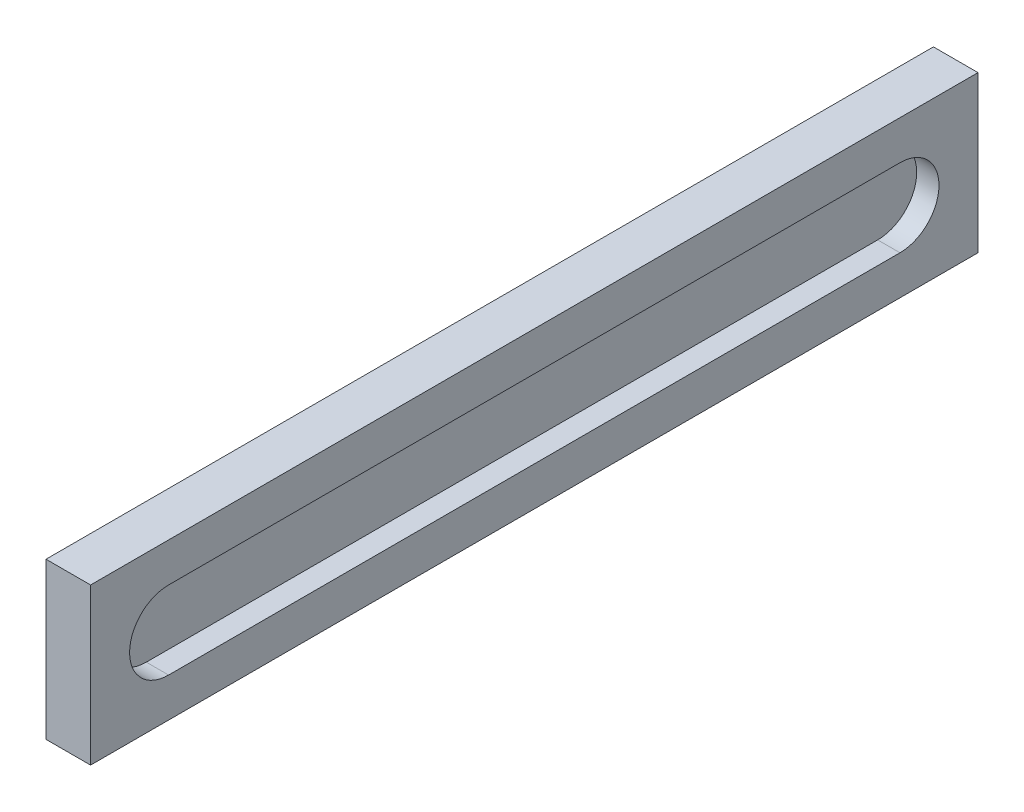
SolidWorks part; units mm, degrees
ref_plane "Front" through (0, 0, 0) normal (0, 0, 1) x (1, 0, 0)
ref_plane "Top" through (0, 0, 0) normal (0, 1, 0) x (1, 0, 0)
ref_plane "Right" through (0, 0, 0) normal (1, 0, 0) x (0, 0, -1)
sketch "Sketch2" plane through (0, 0, 0) normal (1, 0, 0) x (0, 0, -1)
  line L0 (0, 35) -> (17.5, 35) construction
  line L1 (0, 0) -> (398.1006, 0)
  line L2 (0, 0) -> (0, 70)
  line L3 (0, 70) -> (398.1006, 70)
  line L4 (398.1006, 0) -> (398.1006, 70)
  line L5 (17.5, 35) -> (35, 35) construction
  dimension "D1" = 70
  dimension "D2" = 17.5
  dimension "D3" = 17.5
extrude "Boss-Extrude1" add sketch "Sketch2" along normal blind 20
ref_plane "Plane1" through (20, 0, 0) normal (1, 0, 0) x (0, 0, -1)
sketch "Sketch3" plane through (20, 0, 0) normal (1, 0, 0) x (0, 0, -1)
  line L0 (0, 35) -> (17.5, 35) construction
  line L1 (0, 70) -> (0, 0) construction
  line L2 (17.5, 35) -> (35, 35) construction
  line L3 (35, 52.5) -> (363.1006, 52.5)
  line L4 (35, 17.5) -> (363.1006, 17.5)
  line L5 (199.0503, 0) -> (199.0503, 70) construction
  line L6 (0, 0) -> (398.1006, 0) construction
  line L7 (398.1006, 70) -> (0, 70) construction
  arc A0 (35, 52.5) -> (35, 17.5) centre (35, 35) ccw
  arc A1 (363.1006, 52.5) -> (363.1006, 17.5) centre (363.1006, 35) cw
  dimension "D1" = 17.5
extrude "Cut-Extrude1" cut sketch "Sketch3" against normal blind 10
